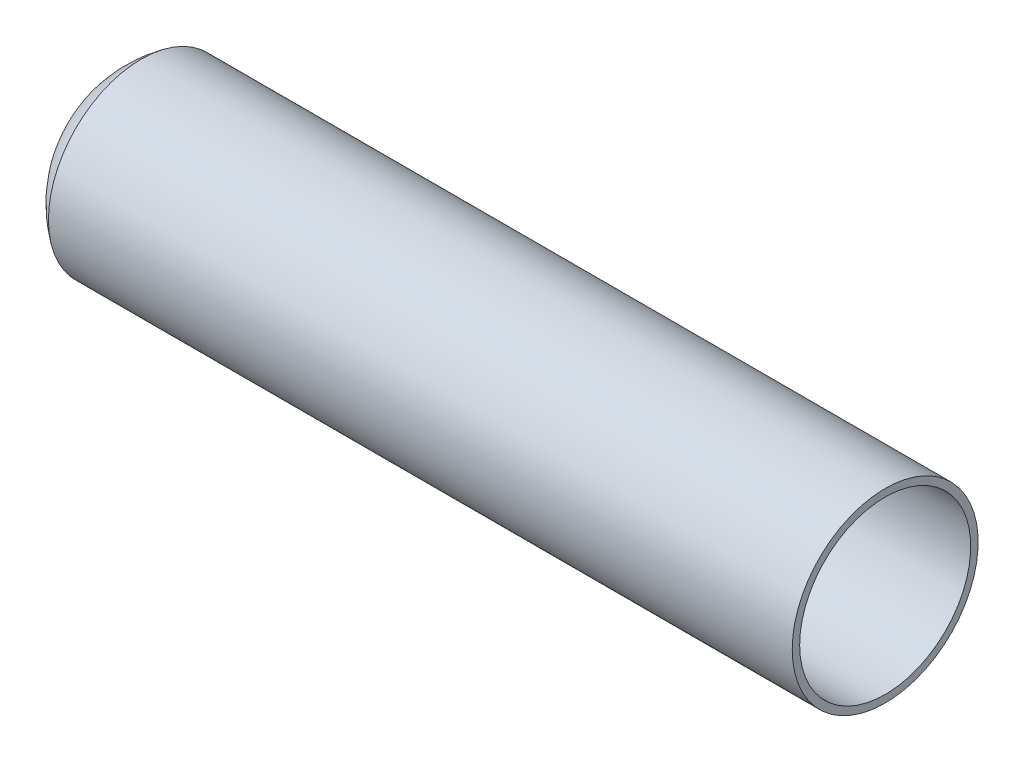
SolidWorks part; units mm, degrees
ref_plane "Plan1" through (0, 0, 0) normal (0, 0, 1) x (1, 0, 0)
ref_plane "Plan2" through (0, 0, 0) normal (0, 1, 0) x (1, 0, 0)
ref_plane "Plan3" through (0, 0, 0) normal (1, 0, 0) x (0, 0, -1)
sketch "Esquisse1" plane through (0, 0, 0) normal (0, 0, 1) x (1, 0, 0)
  line L0 (0, 0) -> (225.2, 0) construction
  line L1 (14.2, 20) -> (14.2, -20) construction
  line L2 (87.4, 20) -> (87.4, -20) construction
  line L3 (225.2, 20) -> (225.2, -20) construction
  line L4 (25.2, 20) -> (25.2, -20) construction
  dimension "D1" = 14.2
  dimension "D2" = 87.4
  dimension "D3" = 11
  dimension "D4" = 200
sketch "Esquisse2" plane through (0, 0, 0) normal (0, 0, 1) x (1, 0, 0)
  line L0 (0, 0) -> (225.2, 0) construction
  line L1 (25.2, 20) -> (25.2, -20) construction
  line L2 (25.2, 25) -> (225.2, 25)
  line L3 (225.2, 20) -> (225.2, -20) construction
  line L7 (14.2, 20) -> (14.2, -20) construction
  line L9 (14.2, 0) -> (225.2, 0) construction
  line L11 (14.2, 0) -> (14.2, 11)
  arc A0 (14.2, 11) -> (25.2, 25) centre (42.6091, 0) cw
  dimension "D1" = 11
  dimension "D2" = 25
revolve "Base-Révol.-Mince" add sketch "Esquisse2" angle 360 about L9
